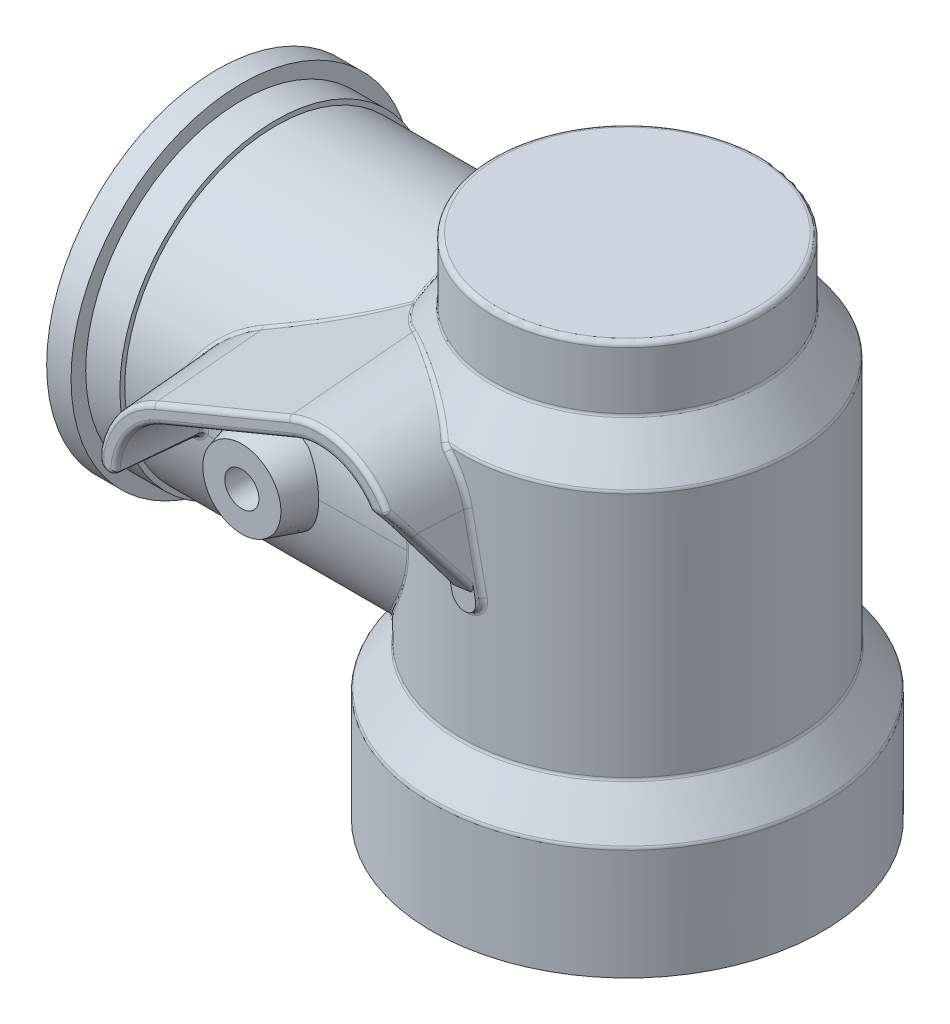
SolidWorks part; units mm, degrees
ref_plane "Plan1" through (0, 0, 0) normal (0, 0, 1) x (1, 0, 0)
ref_plane "Plan2" through (0, 0, 0) normal (0, 1, 0) x (1, 0, 0)
ref_plane "Plan3" through (0, 0, 0) normal (1, 0, 0) x (0, 0, -1)
sketch "Esquisse1" plane through (0, 0, 0) normal (0, 0, 1) x (1, 0, 0)
  line L0 (0, 48) -> (27.5, 48)
  line L1 (27.5, 48) -> (27.5, 35)
  line L2 (27.5, 35) -> (34, 26)
  line L3 (34, 26) -> (34, -25)
  line L4 (0, -56) -> (0, 48)
  line L5 (0, 74.0738) -> (0, -80.3126) construction
  line L6 (34, -25) -> (40, -33)
  line L7 (0, -56) -> (40, -56)
  line L8 (40, -33) -> (40, -56)
  dimension "D1" = 13
  dimension "D2" = 27.5
  dimension "D3" = 9
  dimension "D4" = 48
  dimension "D5" = 8
  dimension "D6" = 34
  dimension "D7" = 23
  dimension "D8" = 40
  dimension "D9" = 104
revolve "Base-Révolution" add sketch "Esquisse1" angle 360 about L5
sketch "Esquisse14" plane through (0, 0, 0) normal (0, 1, 0) x (1, 0, 0)
  line L0 (-90.778, 0) -> (14.0703, 0) construction
  line L1 (0, 0) -> (-84, 0)
  line L2 (0, 0) -> (0, 31)
  line L3 (0, 31) -> (-84, 31)
  line L4 (-84, 0) -> (-84, 31)
  dimension "D1" = 84
  dimension "D2" = 31
revolve "Révolution1" add sketch "Esquisse14" angle 360 about L0
shell "Coque1" thickness 4.5
sketch "Esquisse15" plane through (-84, 0, 0) normal (-1, 0, 0) x (0, 0, 1)
  circle A0 centre (0, 0) radius 32
  dimension "D1" = 64
extrude "Extrusion1" add sketch "Esquisse15" against normal blind 12
sketch "Esquisse16" plane through (-84, 0, 0) normal (-1, 0, 0) x (0, 0, 1)
  circle A0 centre (0, 0) radius 35
  dimension "D1" = 70
extrude "Extrusion2" add sketch "Esquisse16" against normal blind 5
sketch "Esquisse17" plane through (-84, 0, 0) normal (-1, 0, 0) x (0, 0, 1)
  circle A0 centre (0, 0) radius 25.5
  dimension "D1" = 51
extrude "Enlèv. mat.-Extru.1" cut sketch "Esquisse17" against normal up to next
sketch "Esquisse18" plane through (-84, 0, 0) normal (-1, 0, 0) x (0, 0, 1)
  circle A0 centre (0, 0) radius 28
  dimension "D1" = 56
extrude "Enlèv. mat.-Extru.2" cut sketch "Esquisse18" against normal blind 3.5
fillet "Congé1" radius 1
ref_plane "Plan4" through (0, -38, 0) normal (0, -1, 0) x (1, 0, 0)
sketch "Esquisse19" plane through (0, -38, 0) normal (0, -1, 0) x (1, 0, 0)
  circle A0 centre (0, 0) radius 34
  circle A1 centre (0, 0) radius 38
  dimension "D1" = 68
  dimension "D2" = 76
extrude "Extrusion3" add sketch "Esquisse19" along normal blind 7
sketch "Esquisse20" plane through (0, -38, 0) normal (0, -1, 0) x (1, 0, 0)
  line L0 (10, -15) -> (10, -24.9249)
  line L2 (-10, 24.9249) -> (-10, 15)
  line L3 (-10, -15) -> (-10, -24.9249)
  line L4 (10, 24.9249) -> (10, 15)
  line L5 (-23.8747, 12.5) -> (-12.5, 12.5)
  line L6 (12.5, 12.5) -> (23.8747, 12.5)
  line L7 (-23.8747, -12.5) -> (-12.5, -12.5)
  line L8 (12.5, -12.5) -> (23.8747, -12.5)
  arc A0 (9.3396, 25.8654) -> (-9.3396, 25.8654) centre (0, 0) ccw
  arc A2 (24.7756, -11.934) -> (24.7756, 11.934) centre (0, 0) ccw
  arc A3 (-9.3396, -25.8654) -> (9.3396, -25.8654) centre (0, 0) ccw
  arc A4 (-24.7756, 11.934) -> (-24.7756, -11.934) centre (0, 0) ccw
  arc A5 (-10, 24.9249) -> (-9.3396, 25.8654) centre (-9, 24.9249) cw
  arc A6 (10, 24.9249) -> (9.3396, 25.8654) centre (9, 24.9249) ccw
  arc A7 (24.7756, 11.934) -> (23.8747, 12.5) centre (23.8747, 11.5) ccw
  arc A8 (23.8747, -12.5) -> (24.7756, -11.934) centre (23.8747, -11.5) ccw
  arc A9 (9.3396, -25.8654) -> (10, -24.9249) centre (9, -24.9249) ccw
  arc A10 (-9.3396, -25.8654) -> (-10, -24.9249) centre (-9, -24.9249) cw
  arc A11 (-24.7756, -11.934) -> (-23.8747, -12.5) centre (-23.8747, -11.5) ccw
  arc A12 (-24.7756, 11.934) -> (-23.8747, 12.5) centre (-23.8747, 11.5) cw
  arc A13 (-10, 15) -> (-12.5, 12.5) centre (-12.5, 15) cw
  arc A14 (12.5, 12.5) -> (10, 15) centre (12.5, 15) cw
  arc A15 (10, -15) -> (12.5, -12.5) centre (12.5, -15) cw
  arc A16 (-10, -15) -> (-12.5, -12.5) centre (-12.5, -15) ccw
  circle A17 centre (0, 0) radius 35.5
  point P22 (24.4949, -12.5)
  point P27 (-10, -25.6174)
  point P32 (-24.4949, 12.5)
  point P37 (10, 12.5)
  point P40 (10, -12.5)
  point P43 (-10, -12.5)
  dimension "D1" = 55
  dimension "D2" = 1
  dimension "D4" = 2.5
  dimension "D7" = 71
  dimension "D3" = 10
  dimension "D5" = 12.5
  dimension "D6" = 20
extrude "Extrusion4" add sketch "Esquisse20" against normal blind 11
ref_plane "Plan5" through (0, 0, 48) normal (0, 0, 1) x (1, 0, 0)
ref_plane "Plan6" through (-42, 0, 0) normal (-1, 0, 0) x (0, 0, 1)
sketch "Esquisse22" plane through (-42, 0, 0) normal (-1, 0, 0) x (0, 0, 1)
  line L0 (-28, 0) -> (-15.5, 0)
  line L1 (-15.5, 0) -> (-15.5, 6.5)
  line L2 (-15.5, 6.5) -> (-28, 8.375)
  line L3 (-28, 0) -> (-28, 8.375)
  line L4 (0, 16.8451) -> (0, -13.434) construction
  line L6 (15.5, 6.5) -> (27.0112, 8.2267)
  line L7 (15.5, 0) -> (15.5, 6.5)
  line L8 (27.0112, 0) -> (15.5, 0)
  line L9 (-28, 0) -> (30.108, 0) construction
  line L10 (30.108, 0) -> (30.108, 10)
  line L11 (30.108, 10) -> (37, 8)
  line L12 (37, 8) -> (37, 0)
  line L13 (37, 0) -> (30.108, 0)
  line L14 (27.0112, 0) -> (27.0112, 8.2267)
  circle A1 centre (0, 0) radius 28 construction
  circle A3 centre (0, 0) radius 35 construction
  dimension "D6" = 37
  dimension "D2" = 6.5
  dimension "D4" = 10
  dimension "D5" = 8
revolve "Révolution2" add sketch "Esquisse22" angle 360 about L9
hole_wizard "Dégagement M81" positions "Esquisse24" profile "Esquisse23" hole size "M8" standard "Ansi Métrique"
sketch "Esquisse24" plane through (0, 0, 37) normal (0, 0, 1) x (1, 0, 0)
  circle A0 centre (-42, 0) radius 8 construction
  point P0 (-42, 0)
sketch "Esquisse23" plane through (-42, 0, 37) normal (1, 0, 0) x (0, -1, 0)
  line L0 (0, 0) -> (0, 64.103)
  line L1 (0, 64.103) -> (3.5, 62)
  line L2 (3.5, 62) -> (3.5, 0)
  line L5 (3.5, 0) -> (0, 0)
  line L10 (0, 64.103) -> (-3.5, 62) construction
  line L11 (0, -6.35) -> (0, 107.95) construction
  dimension "Diamètre du perçage" = 7
  dimension "Profondeur du perçage" = 62
  dimension "Angle de pointe" = 118
sketch "Esquisse25" plane through (0, 0, 48) normal (0, 0, 1) x (1, 0, 0)
  line L0 (33.8107, 26.2621) -> (-29.2231, 26.2621) construction
  line L1 (-47.7464, 13.8556) -> (-20.1315, 25.3085)
  line L3 (-60.1659, 3.5) -> (-60.1659, 1.75)
  line L4 (-0.2707, 1.4229) -> (-3.0632, 16.0986)
  line L6 (-49.0873, 17.0886) -> (-21.4724, 28.5415)
  line L7 (3.1676, 2.0771) -> (0.3751, 16.7529)
  arc A0 (-47.7464, 13.8556) -> (-56.9814, 0.7477) centre (-42, 0) ccw
  arc A1 (-3.0632, 16.0986) -> (-20.1315, 25.3085) centre (-15.3429, 13.7621) ccw
  arc A2 (-49.0873, 17.0886) -> (-60.1659, 3.5) centre (-42, 0) ccw
  arc A3 (0.3751, 16.7529) -> (-21.4724, 28.5415) centre (-15.3429, 13.7621) ccw
  arc A4 (-0.2707, 1.4229) -> (3.1676, 2.0771) centre (1.4484, 1.75) ccw
  arc A5 (-60.1659, 1.75) -> (-56.9814, 0.7477) centre (-58.4159, 1.75) ccw
  dimension "D1" = 30
  dimension "D2" = 25
  dimension "D3" = 30
  dimension "D4" = 3.5
extrude "Extrusion7" add sketch "Esquisse25" against normal up to body draft 4 separate body
sketch "Esquisse26" plane through (6.7029, 1.2754, 0.4771) normal (0.98, 0.1865, 0.0698) x (0.0685, 0.013, -0.9976)
  line L0 (-34.7806, -1.6079) -> (-34.7806, 2.6764)
  line L1 (-39.7993, -0.1477) -> (-32.9269, -2.1473) construction
  line L2 (-34.7806, 2.6764) -> (-48.9824, 22.6026)
  line L3 (-48.9824, 22.6026) -> (-48.9824, -1.6079)
  line L4 (-48.9824, -1.6079) -> (-34.7806, -1.6079)
extrude "Enlèv. mat.-Extru.4" cut sketch "Esquisse26" against normal up to next
fillet "Congé7" radius 1
fillet "Congé10" radius 1
fillet "Congé13" radius 1
hole_wizard "Trou taraudé M5x0.81" positions "Esquisse29" profile "Esquisse28" tap size "M5x0.8" standard "Ansi Métrique"
sketch "Esquisse29" plane through (0, -38, 0) normal (0, -1, 0) x (1, 0, 0)
  circle A0 centre (-16, 18) radius 3.75 construction
  point P0 (-16, 18)
sketch "Esquisse28" plane through (-16, -38, 18) normal (1, 0, 0) x (0, 0, -1)
  line L0 (0, 0) -> (0, 86)
  line L1 (0, 86) -> (2.1, 86)
  line L2 (2.1, 86) -> (2.1, 0)
  line L5 (2.1, 0) -> (0, 0)
  line L11 (0, -6.35) -> (0, 107.95) construction
  dimension "Diamètre du trou pour taraudage jusqu'au prochain" = 4.2
  dimension "Profondeur du trou pour taraudage jusqu'au prochain" = 86
hole_wizard "Trou taraudé M5x0.82" positions "Esquisse31" profile "Esquisse30" tap size "M5x0.8" standard "Ansi Métrique"
sketch "Esquisse31" plane through (0, -38, 0) normal (0, -1, 0) x (1, 0, 0)
  circle A0 centre (16, 18) radius 3.75 construction
  point P0 (16, 18)
sketch "Esquisse30" plane through (16, -38, 18) normal (1, 0, 0) x (0, 0, -1)
  line L0 (0, 0) -> (0, 15.2618)
  line L1 (0, 15.2618) -> (2.1, 14)
  line L2 (2.1, 14) -> (2.1, 0)
  line L5 (2.1, 0) -> (0, 0)
  line L10 (0, 15.2618) -> (-2.1, 14) construction
  line L11 (0, -6.35) -> (0, 107.95) construction
  dimension "Diamètre du trou pour taraudage" = 4.2
  dimension "Profondeur du trou pour taraudage" = 14
  dimension "Angle de pointe" = 118
mirror "Symétrie1" about plane through (0, 0, 0) normal (0, 0, 1)
